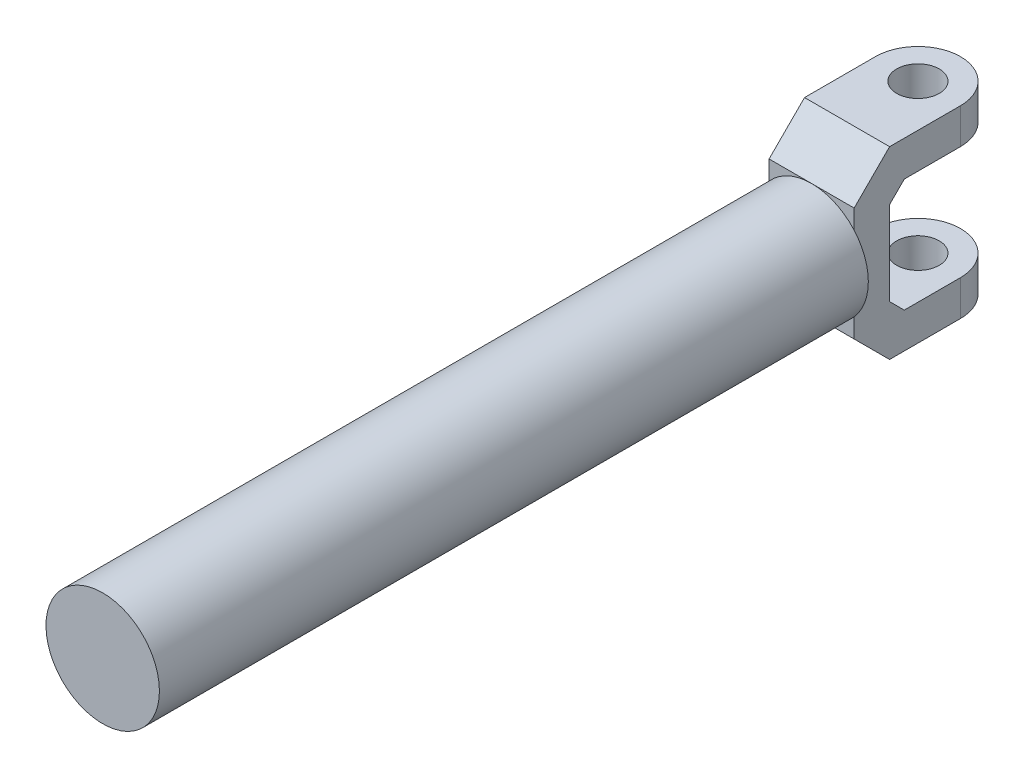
SolidWorks part; units mm, degrees
ref_plane "Front Plane" through (0, 0, 0) normal (0, 0, 1) x (1, 0, 0)
ref_plane "Top Plane" through (0, 0, 0) normal (0, 1, 0) x (1, 0, 0)
ref_plane "Right Plane" through (0, 0, 0) normal (1, 0, 0) x (0, 0, -1)
sketch "Sketch1" plane through (0, 0, 0) normal (0, 0, 1) x (1, 0, 0)
  circle A0 centre (0, 0) radius 40
  dimension "D1" = 80
extrude "Boss-Extrude1" add sketch "Sketch1" along normal blind 500
sketch "Sketch2" plane through (0, 0, 0) normal (1, 0, 0) x (0, 0, -1)
  line L0 (0, -40) -> (0, 40)
  line L1 (0, -40) -> (0, 40) construction
  line L2 (0, 40) -> (25, 65)
  line L3 (25, 65) -> (105, 65)
  line L4 (105, 65) -> (105, 40)
  line L5 (105, 40) -> (35.3553, 40)
  line L6 (35.3553, 40) -> (25, 29.6447)
  line L7 (25, 29.6447) -> (25, -29.6447)
  line L8 (0, 0) -> (25, 0) construction
  line L9 (35.3553, -40) -> (25, -29.6447)
  line L10 (105, -40) -> (35.3553, -40)
  line L11 (105, -65) -> (105, -40)
  line L12 (25, -65) -> (105, -65)
  line L13 (0, -40) -> (25, -65)
  dimension "D1" = 25
  dimension "D2" = 25
  dimension "D3" = 25
  dimension "D4" = 40
  dimension "D5" = 105
  dimension "D6" = 80
extrude "Boss-Extrude2" add sketch "Sketch2" along normal mid plane 60
sketch "Sketch3" plane through (0, 0, 0) normal (0, 1, 0) x (1, 0, 0)
  line L0 (-30, 75) -> (30, 75) construction
  line L3 (30, 105) -> (-30, 105) construction
  line L4 (-30, 105) -> (-30, 25) construction
  line L5 (30, 105) -> (30, 25) construction
  circle A0 centre (0, 75) radius 15
  dimension "D1" = 30
  dimension "D2" = 30
extrude "Cut-Extrude1" cut sketch "Sketch3" against normal through all both and the other way through all
fillet "Fillet1" radius 30 4 edges at (-30, -52.5, -105) (30, -52.5, -105) (-30, 52.5, -105) (30, 52.5, -105)
